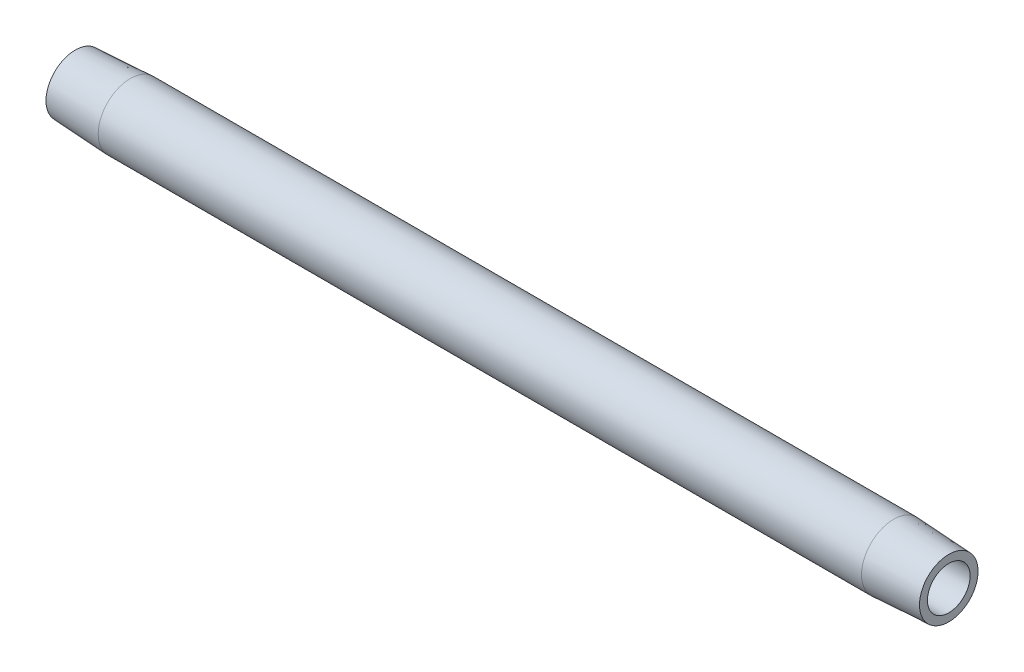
SolidWorks part; units mm, degrees
ref_plane "Front Plane" through (0, 0, 0) normal (0, 0, 1) x (1, 0, 0)
ref_plane "Top Plane" through (0, 0, 0) normal (0, 1, 0) x (1, 0, 0)
ref_plane "Right Plane" through (0, 0, 0) normal (1, 0, 0) x (0, 0, -1)
sketch "Sketch2" plane through (0, 0, 0) normal (0, 0, 1) x (1, 0, 0)
  line L0 (0.4761, 0) -> (50000.4761, 0) construction
  line L1 (0, -11.3625) -> (0, 49988.6375) construction
  line L7 (8.81, 5.1435) -> (0, 4.6818)
  line L8 (130.89, 5.1435) -> (8.81, 5.1435)
  line L9 (139.7, 4.6818) -> (130.89, 5.1435)
  line L10 (139.7, 3.4163) -> (139.7, 4.6818)
  line L11 (139.7, 3.4163) -> (0, 3.4163)
  line L12 (0, 4.6818) -> (0, 3.4163)
  dimension "D1" = 6.8326
  dimension "D2" = 10.287
  dimension "D3" = 3
  dimension "D4" = 3
  dimension "D5" = 8.81
  dimension "D6" = 8.81
  dimension "D7" = 139.7
revolve "Revolve1" add sketch "Sketch2" angle 360 about L0
